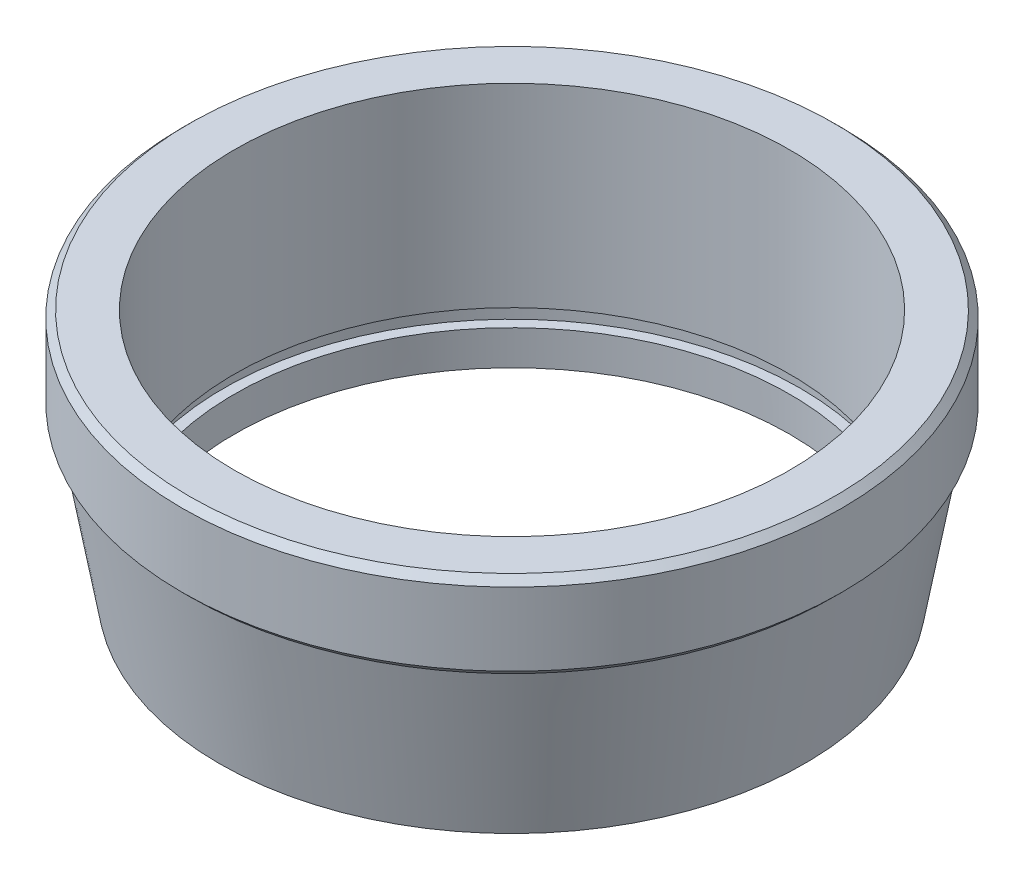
SolidWorks part; units mm, degrees
ref_plane "Přední rovina" through (0, 0, 0) normal (0, 0, 1) x (1, 0, 0)
ref_plane "Horní rovina" through (0, 0, 0) normal (0, 1, 0) x (1, 0, 0)
ref_plane "Pravá rovina" through (0, 0, 0) normal (1, 0, 0) x (0, 0, -1)
sketch "Skica1" plane through (0, 0, 0) normal (0, 1, 0) x (1, 0, 0)
  circle A0 centre (0, 0) radius 9.25
extrude "Přidat vysunutím1" add sketch "Skica1" against normal blind 4.6 draft 10
sketch "Skica2" plane through (0, 0, 0) normal (0, 1, 0) x (-1, 0, 0)
  circle A0 centre (0, 0) radius 9.5
extrude "Přidat vysunutím2" add sketch "Skica2" along normal blind 2.5
chamfer "Zkosení1" distance 0.2 angle 45 2 edges at (0, 0, 9.5) (0, 2.5, 9.5)
sketch "Skica3" plane through (0, 2.5, 0) normal (0, 1, 0) x (1, 0, 0)
  circle A0 centre (0, 0) radius 8
extrude "Odebrat vysunutím1" cut sketch "Skica3" against normal blind 2.5
sketch "Skica4" plane through (0, -4.6, 0) normal (0, -1, 0) x (1, 0, 0)
  circle A0 centre (0, 0) radius 8
extrude "Odebrat vysunutím2" cut sketch "Skica4" against normal up to surface (4.6 mm away)
sketch "Skica5" plane through (0, 0, 0) normal (0, 0, 1) x (1, 0, 0)
  line L0 (-8.4389, -4.6) -> (8.4389, -4.6) construction
  line L1 (-8.3, -3.6) -> (-8, -3.6)
  line L2 (-8.3, -3.6) -> (-8.3, -3.1)
  line L3 (-8.3, -3.1) -> (-8, -3.1)
  line L4 (-8, -3.6) -> (-8, -3.1)
  line L5 (-8, -4.6) -> (8, -4.6) construction
  point P8 (-3.25, -4.6)
  dimension "D1" = 0.3
  dimension "D2" = 0.5
  dimension "D3" = 1
  dimension "D5" = 8.3
ref_axis "Osa1" through (0, 2.5, 0) along (0, -1, 0)
revolve "Odebrat rotací1" cut sketch "Skica5" angle 360 about axis through (0, 2.5, 0) along (0, -1, 0)
